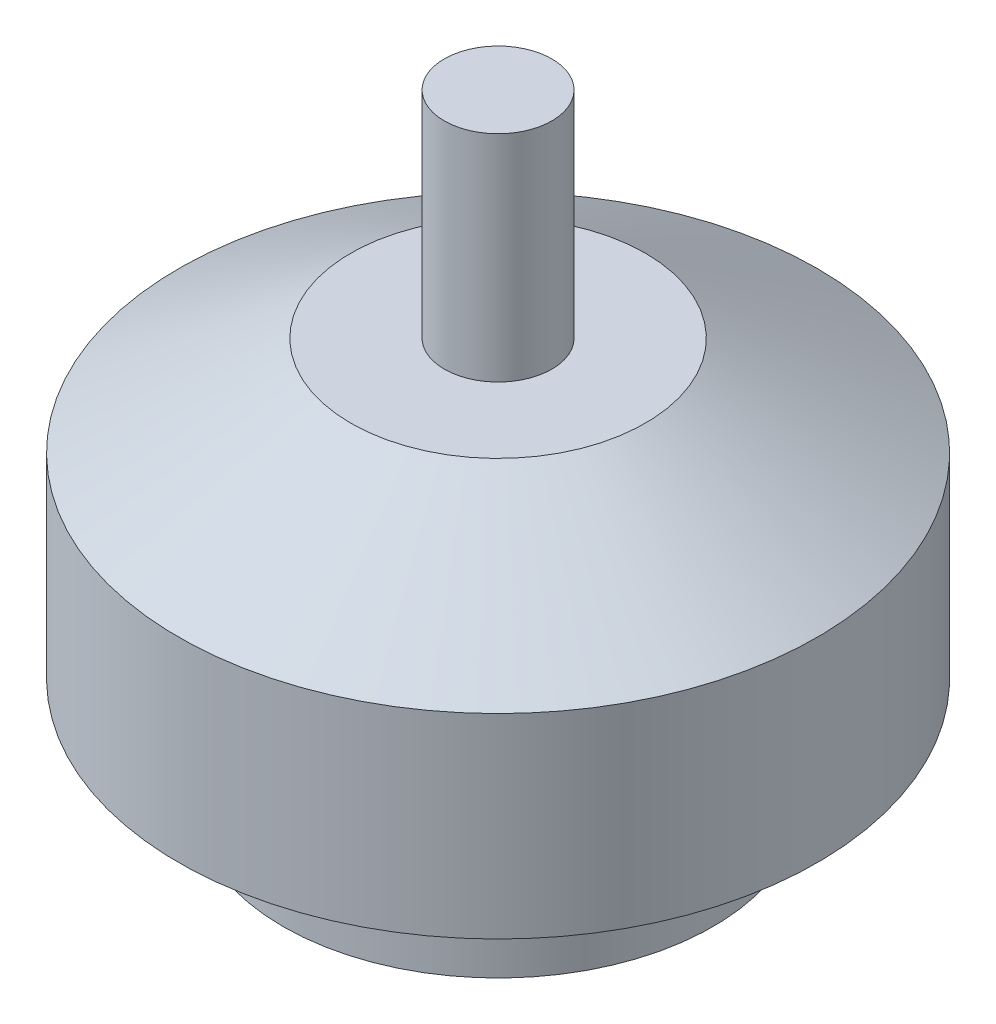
SolidWorks part; units mm, degrees
ref_plane "Front Plane" through (0, 0, 0) normal (0, 0, 1) x (1, 0, 0)
ref_plane "Top Plane" through (0, 0, 0) normal (0, 1, 0) x (1, 0, 0)
ref_plane "Right Plane" through (0, 0, 0) normal (1, 0, 0) x (0, 0, -1)
sketch "Sketch1" plane through (0, 0, 0) normal (0, 1, 0) x (1, 0, 0)
  circle A0 centre (0, 0) radius 10
  dimension "D1" = 20
extrude "Boss-Extrude1" add sketch "Sketch1" along normal blind 5
sketch "Sketch2" plane through (0, 5, 0) normal (0, 1, 0) x (1, 0, 0)
  circle A0 centre (0, 0) radius 14.85
  dimension "D1" = 29.7
extrude "Boss-Extrude2" add sketch "Sketch2" along normal blind 13.7
chamfer "Chamfer1" distance 8 angle 30 1 edges at (0, 18.7, 14.85)
sketch "Sketch3" plane through (0, 18.7, 0) normal (0, 1, 0) x (1, 0, 0)
  circle A0 centre (0, 0) radius 2.5
  dimension "D1" = 5
extrude "Boss-Extrude3" add sketch "Sketch3" along normal blind 10
